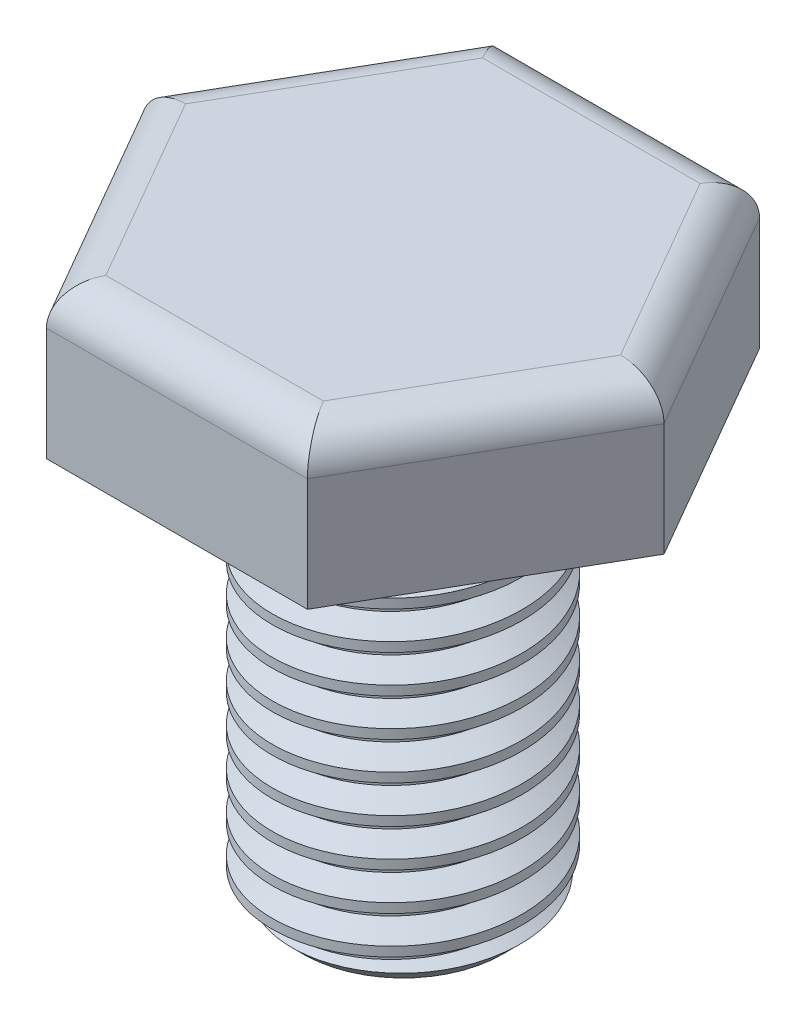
SolidWorks part; units mm, degrees
ref_plane "Front Plane" through (0, 0, 0) normal (0, 0, 1) x (1, 0, 0)
ref_plane "Top Plane" through (0, 0, 0) normal (0, 1, 0) x (1, 0, 0)
ref_plane "Right Plane" through (0, 0, 0) normal (1, 0, 0) x (0, 0, -1)
sketch "Esquisse2" plane through (0, 0, 6) normal (0, -1, 0) x (1, 0, 0)
  circle A0 centre (0, -6) radius 4.975
  dimension "D1" = 9.95
extrude "Boss.-Extru.2" add sketch "Esquisse2" along normal blind 17
chamfer "Chanfrein1" distance 1 angle 45 1 edges at (0, -17, -4.975)
thread "Filetage1" pitch 1.5 start angle 0, offset 2, length 0, pitch 1.5, diameter 9.95
ref_plane "Plan1" through (4.975, -18, 0) normal (0, 0, 1) x (1, 0, 0)
sketch "Profil de filetage1" plane through (4.975, -18, 0) normal (0, 0, 1) x (1, 0, 0)
  line L0 (0, 0) -> (0, 1.5) construction
  line L1 (0, 1.125) -> (-0.8119, 0.6563)
  line L2 (-0.8119, 0.6563) -> (-0.8119, 0.4688)
  line L3 (-0.8119, 0.4688) -> (0, 0)
  line L4 (-0.8119, 0.5625) -> (0, 0.5625) construction
  line L11 (0, 1.125) -> (0, 0)
  point P6 (0, 0)
  dimension "Pitch" = 1.5
  dimension "Profile_Angle" = 60
  dimension "Profile_Land" = 0.1875
  dimension "Profile_Height" = 0.8119
sketch "Esquisse5" plane through (0, 0, 0) normal (0, 1, 0) x (1, 0, 0)
  line L1 (10.3923, 0) -> (5.1962, 9)
  line L2 (5.1962, 9) -> (-5.1962, 9)
  line L3 (-5.1962, 9) -> (-10.3923, 0)
  line L4 (-10.3923, 0) -> (-5.1962, -9)
  line L5 (-5.1962, -9) -> (5.1962, -9)
  line L6 (5.1962, -9) -> (10.3923, 0)
  circle A0 centre (0, 0) radius 9 construction
  dimension "D1" = 18
extrude "Boss.-Extru.3" add sketch "Esquisse5" along normal blind 6 contours L3 L4 L5 L6 L1 L2
fillet "Congé1" radius 1.5 6 edges at (7.7942, 6, -4.5) (7.7942, 6, 4.5) (0, 6, 9) (-7.7942, 6, 4.5) (-7.7942, 6, -4.5) (0, 6, -9)
